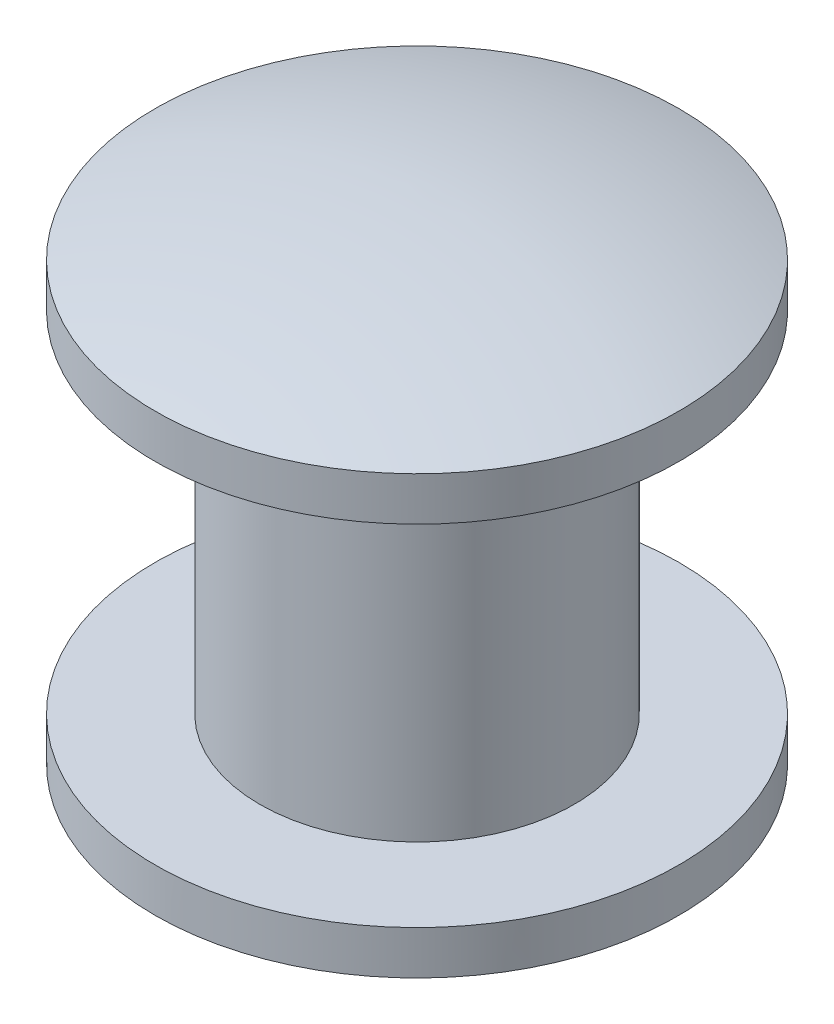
SolidWorks part; units mm, degrees
ref_plane "Front XY" through (0, 0, 0) normal (0, 0, 1) x (1, 0, 0)
ref_plane "Top XZ" through (0, 0, 0) normal (0, 1, 0) x (1, 0, 0)
ref_plane "Right YZ" through (0, 0, 0) normal (1, 0, 0) x (0, 0, -1)
sketch "Sketch1" plane through (0, 0, 0) normal (1, 0, 0) x (0, 0, -1)
  line L2 (3.81, -0.635) -> (3.81, -1.27)
  line L3 (3.81, -1.27) -> (2.286, -1.27)
  line L4 (2.286, -1.27) -> (2.286, -6.35)
  line L5 (2.286, -6.35) -> (3.81, -6.35)
  line L6 (3.81, -6.35) -> (3.81, -6.985)
  line L8 (0, -7.62) -> (0, 0)
  arc A0 (0, 0) -> (3.81, -0.635) centre (0, -11.7475) cw
  arc A1 (0, -7.62) -> (3.81, -6.985) centre (0, 4.1275) ccw
  dimension "D1" = 5.08
  dimension "D2" = 3.81
  dimension "D3" = 2.286
  dimension "D4" = 0.635
  dimension "D5" = 7.62
  dimension "D6" = 0.635
  dimension "D7" = 1.27
revolve "Revolve1" add sketch "Sketch1" angle 360 about L8
